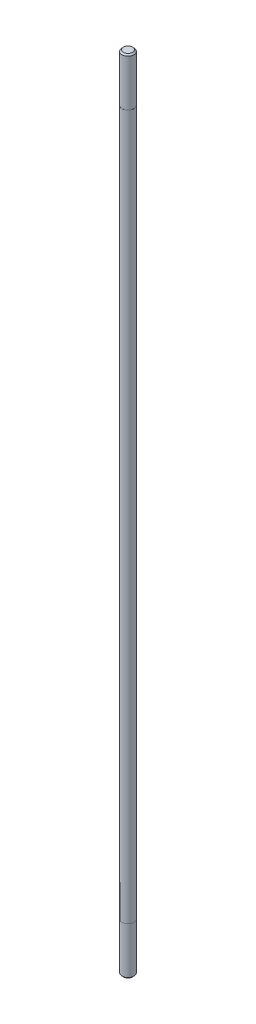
SolidWorks part; units mm, degrees
ref_plane "Front" through (0, 0, 0) normal (0, 0, 1) x (1, 0, 0)
ref_plane "Top" through (0, 0, 0) normal (0, 1, 0) x (1, 0, 0)
ref_plane "Right" through (0, 0, 0) normal (1, 0, 0) x (0, 0, -1)
sketch "Sketch1" plane through (0, 0, 0) normal (0, 1, 0) x (1, 0, 0)
  circle A0 centre (0, 0) radius 1.5
extrude "Extrude1" add sketch "Sketch1" along normal blind 176
sketch "Sketch2" plane through (0, 176, 0) normal (0, 1, 0) x (-1, 0, 0)
  circle A0 centre (0, 0) radius 1.49
extrude "Extrude2" add sketch "Sketch2" along normal blind 12
sketch "Sketch3" plane through (0, 0, 0) normal (0, -1, 0) x (1, 0, 0)
  circle A0 centre (0, 0) radius 1.49
extrude "Extrude3" add sketch "Sketch3" along normal blind 12
chamfer "Chamfer1" distance 0.35 angle 45 1 edges at (0, 188, 1.49)
chamfer "Chamfer2" distance 0.35 angle 45 1 edges at (0, -12, -1.49)
